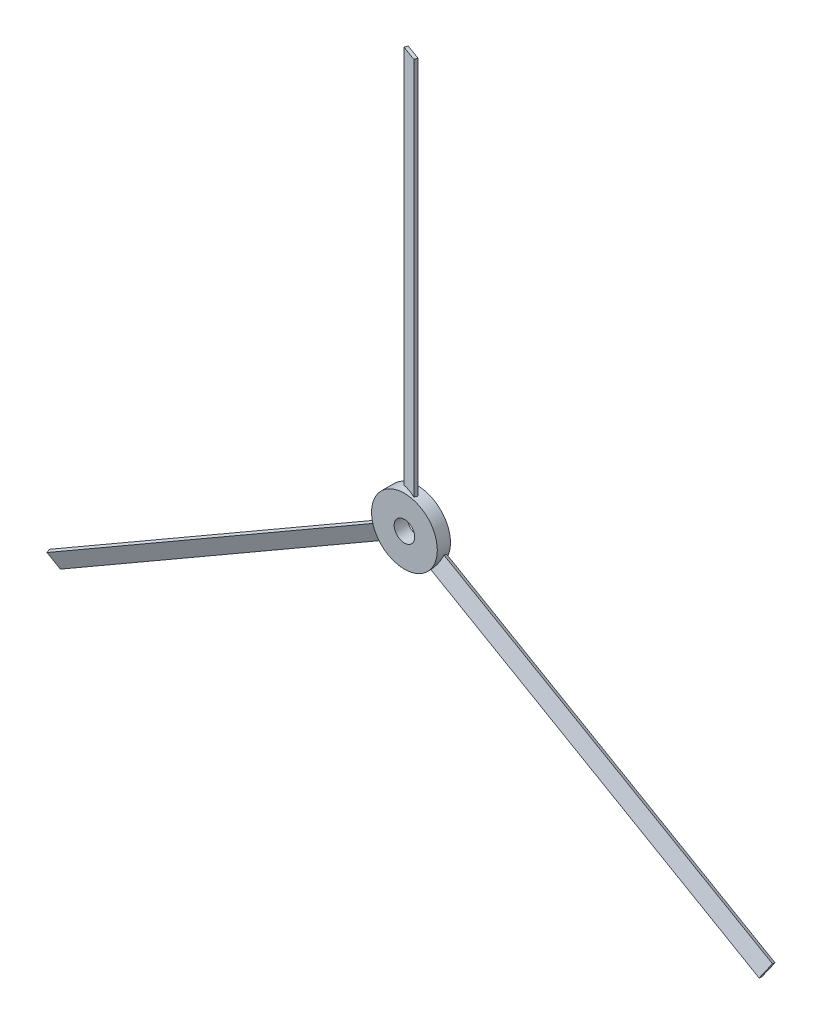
SolidWorks part; units mm, degrees
ref_plane "Front Plane" through (0, 0, 0) normal (0, 0, 1) x (1, 0, 0)
ref_plane "Top Plane" through (0, 0, 0) normal (0, 1, 0) x (1, 0, 0)
ref_plane "Right Plane" through (0, 0, 0) normal (1, 0, 0) x (0, 0, -1)
sketch "Sketch1" plane through (0, 0, 0) normal (0, 0, 1) x (1, 0, 0)
  circle A0 centre (0, 0) radius 400
  dimension "D1" = 800
extrude "Extrude1" add sketch "Sketch1" along normal mid plane 160
sketch "Sketch2" plane through (0, 0, 0) normal (0, 1, 0) x (1, 0, 0)
  line L0 (0, 0) -> (270.7256, 0) construction
  line L1 (0, 0) -> (0, 134.3833) construction
  line L2 (0, 0) -> (254.4154, -92.5996) construction
  line L3 (0, 0) -> (49.5925, 136.2542) construction
  line L4 (-100.8097, 15.4082) -> (87.1289, -52.9959)
  line L5 (87.1289, -52.9959) -> (100.8097, -15.4082)
  line L6 (100.8097, -15.4082) -> (-87.1289, 52.9959)
  line L7 (-87.1289, 52.9959) -> (-100.8097, 15.4082)
  dimension "D1" = 20
  dimension "D2" = 200
  dimension "D3" = 40
  dimension "D4" = 100
  dimension "D5" = 20
extrude "Extrude2" add sketch "Sketch2" along normal blind 5000
pattern_circular "CirPattern1" count 3 over 360 about axis through (0, 0, 0) along (0, 0, 1) of "Extrude2"
sketch "Sketch3" plane through (0, 0, 80) normal (0, 0, 1) x (1, 0, 0)
  circle A0 centre (0, 0) radius 125
  dimension "D1" = 250
extrude "Cut-Extrude1" cut sketch "Sketch3" against normal through all
sketch "Sketch4" plane through (0, 0, 80) normal (0, 0, 1) x (1, 0, 0)
  line L0 (0, 0) -> (649.5191, 375)
  line L1 (0, 0) -> (-649.5191, 375)
  line L2 (0, 0) -> (0, 1194.1302) construction
  circle A0 centre (0, 0) radius 750 construction
  dimension "D3" = 1500
  dimension "D1" = 120
  dimension "D2" = 60
extrude "Cut-Extrude2" [suppressed] cut sketch "Sketch4" against normal through all and the other way through all
equation "\"D4@Sketch2\" = \"D2@Sketch2\" / 2"
equation "\"D5@Sketch2\" = \"D3@Sketch2\" / 2"
